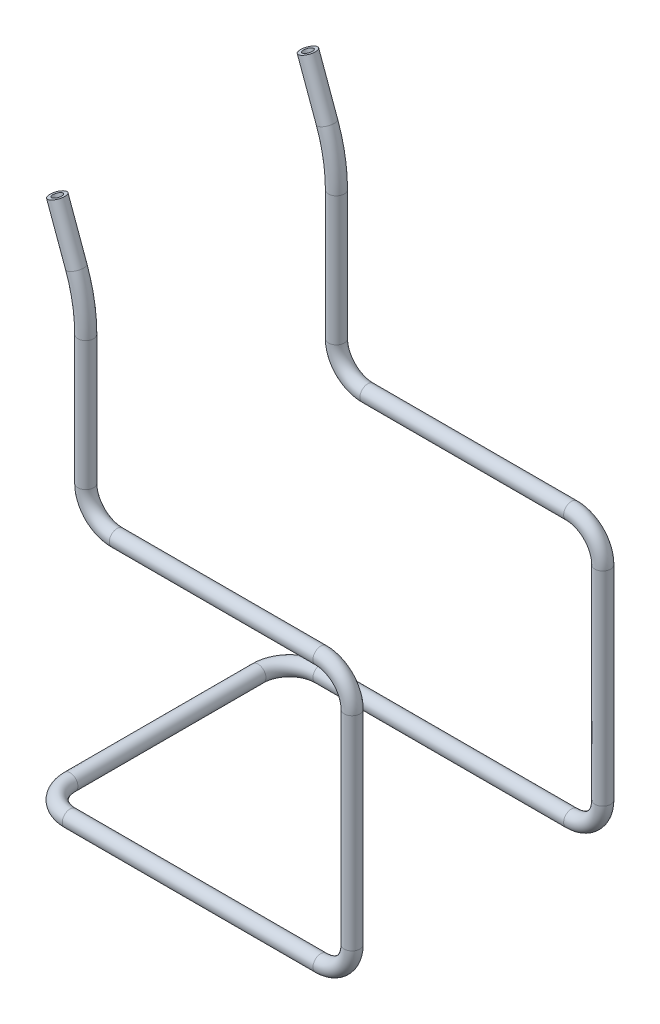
SolidWorks part; units mm, degrees
ref_plane "Front" through (0, 0, 0) normal (0, 0, 1) x (1, 0, 0)
ref_plane "Top" through (0, 0, 0) normal (0, 1, 0) x (1, 0, 0)
ref_plane "Right" through (0, 0, 0) normal (1, 0, 0) x (0, 0, -1)
ref_plane "Plane1" through (0, 0, 40) normal (0, 0, 1) x (1, 0, 0)
sketch3d "3DSketch1"
  line L0 (0, 0, 0) -> (0, 0, 30)
  line L1 (10, 0, 40) -> (90, 0, 40)
  line L2 (100, 10, 40) -> (100, 75, 40)
  line L3 (90, 85, 40) -> (25, 85, 40)
  line L4 (15, 95, 40) -> (15, 136.1837, 40)
  line L5 (11.9846, 153.2847, 40) -> (5.9007, 170, 40)
  arc A0 (10, 0, 40) -> (0, 0, 30) centre (10, 0, 30) ccw
  arc A1 (100, 10, 40) -> (90, 0, 40) centre (90, 10, 40) ccw
  arc A2 (90, 85, 40) -> (100, 75, 40) centre (90, 75, 40) ccw
  arc A3 (15, 95, 40) -> (25, 85, 40) centre (25, 95, 40) ccw
  arc A4 (11.9846, 153.2847, 40) -> (15, 136.1837, 40) centre (-35, 136.1837, 40) ccw
  point P9 (0, 0, 40)
  point P11 (10, -10, 30)
  point P14 (100, 0, 40)
  point P15 (90, 10, 30)
  point P18 (100, 85, 40)
  point P19 (90, 75, 30)
  point P22 (15, 85, 40)
  point P23 (25, 95, 50)
  point P26 (15, 145, 40)
  point P27 (-35, 136.1837, -10)
  dimension "D8" = 40
  dimension "D9" = 10
  dimension "D10" = 10
  dimension "D11" = 10
  dimension "D12" = 50
  dimension "D13" = 10
  dimension "D2" = 100
  dimension "D3" = 85
  dimension "D4" = 85
  dimension "D5" = 170
  dimension "D6" = 20
  dimension "D7" = 60
sketch "Sketch1" plane through (0, 0, 0) normal (0, 0, 1) x (1, 0, 0)
  circle A0 centre (0, 0) radius 2.5
  dimension "D1" = 5
sweep "Sweep-Thin1" add profiles "Sketch1" path "3DSketch1" parameters "D1"=1
mirror "Mirror1" about plane through (0, 0, 0) normal (0, 0, 1)
